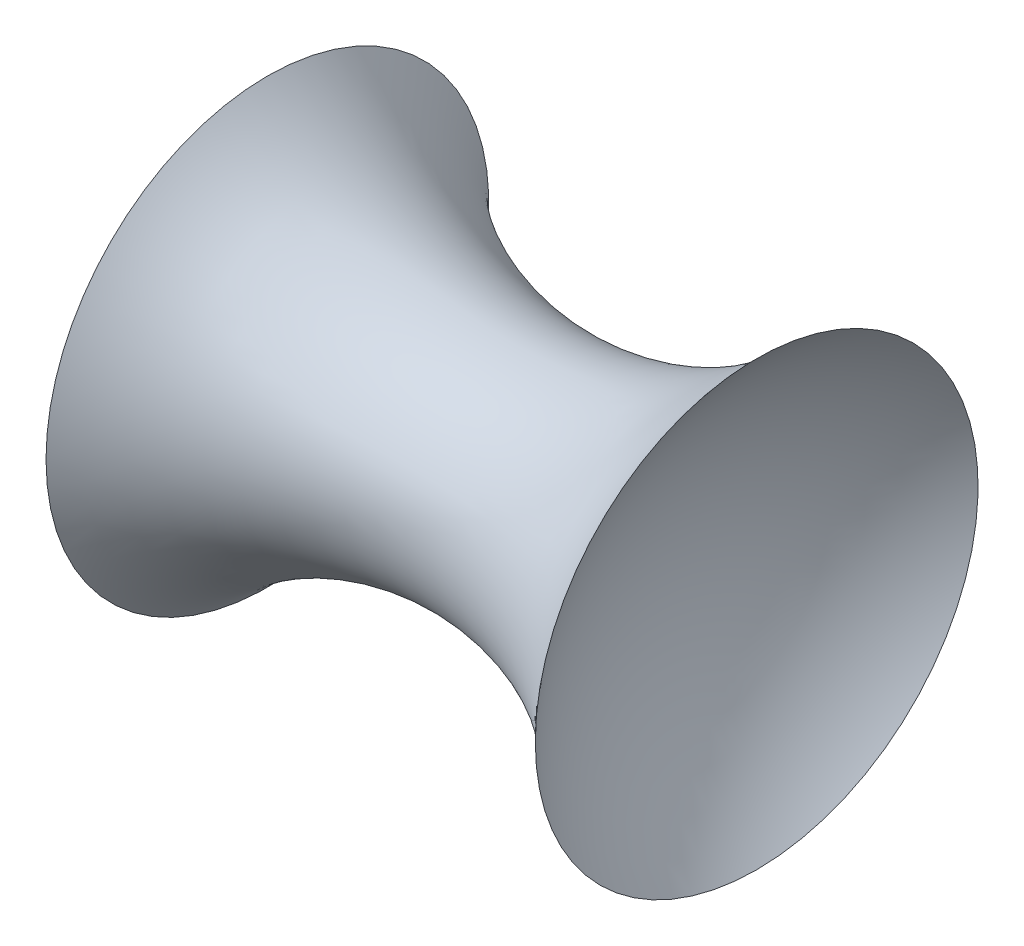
SolidWorks part; units mm, degrees
ref_plane "Ebene vorne" through (0, 0, 0) normal (0, 0, 1) x (1, 0, 0)
ref_plane "Ebene oben" through (0, 0, 0) normal (0, 1, 0) x (1, 0, 0)
ref_plane "Ebene rechts" through (0, 0, 0) normal (1, 0, 0) x (0, 0, -1)
sketch "Skizze1" plane through (0, 0, 0) normal (0, 0, 1) x (1, 0, 0)
  line L0 (0, 0) -> (44.4852, 0) construction
  line L1 (0, 0) -> (44.4852, 0) construction
  line L2 (29.4852, 0) -> (15, 0)
  circle A0 centre (44.4852, 0) radius 15 construction
  arc A1 (33.3639, -10.0656) -> (11.1213, -10.0656) centre (22.2426, -20.1312) ccw construction
  circle A2 centre (0, 0) radius 15 construction
  arc A3 (29.4852, 0) -> (33.3639, -10.0656) centre (44.4852, 0) ccw
  arc A4 (33.3639, -10.0656) -> (11.1213, -10.0656) centre (22.2426, -20.1312) ccw
  arc A5 (11.1213, -10.0656) -> (15, 0) centre (0, 0) ccw
revolve "Rotation1" add sketch "Skizze1" angle 360 about L1
